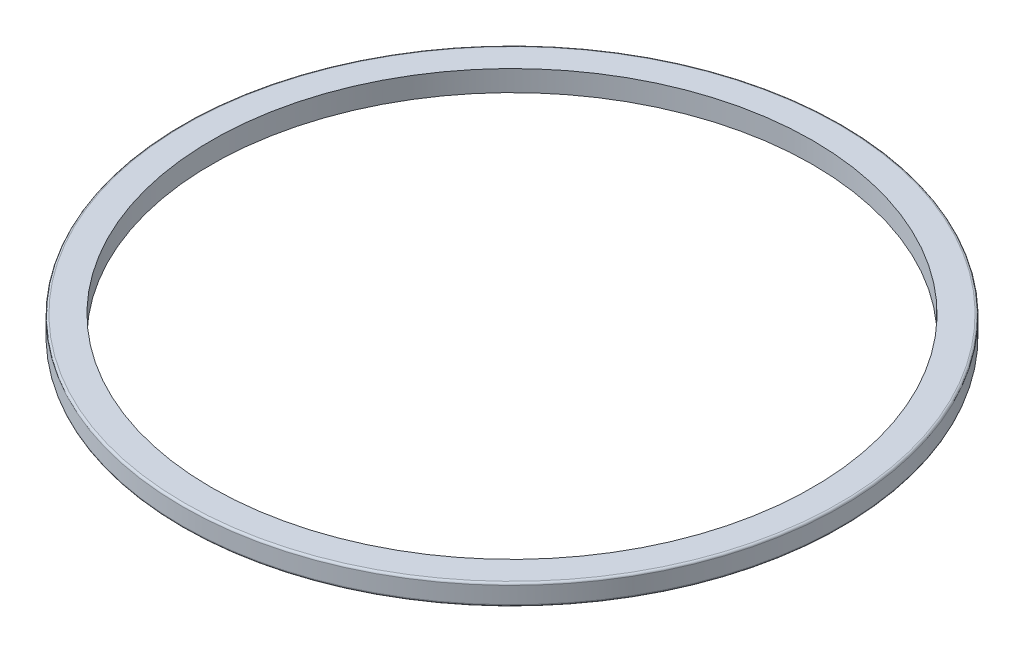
SolidWorks part; units mm, degrees
ref_plane "Front Plane" through (0, 0, 0) normal (0, 0, 1) x (1, 0, 0)
ref_plane "Top Plane" through (0, 0, 0) normal (0, 1, 0) x (1, 0, 0)
ref_plane "Right Plane" through (0, 0, 0) normal (1, 0, 0) x (0, 0, -1)
sketch "Sketch1" plane through (0, 0, 0) normal (0, 1, 0) x (1, 0, 0)
  circle A0 centre (0, 0) radius 100.33
  circle A1 centre (0, 0) radius 91.5111
  circle A2 centre (0, 0) radius 91.5111 construction
  dimension "D1" = 200.66
extrude "Boss-Extrude1" add sketch "Sketch1" along normal blind 6.35
fillet "Fillet1" radius 0.635 2 edges at (0, 0, 100.33) (0, 6.35, 100.33)
